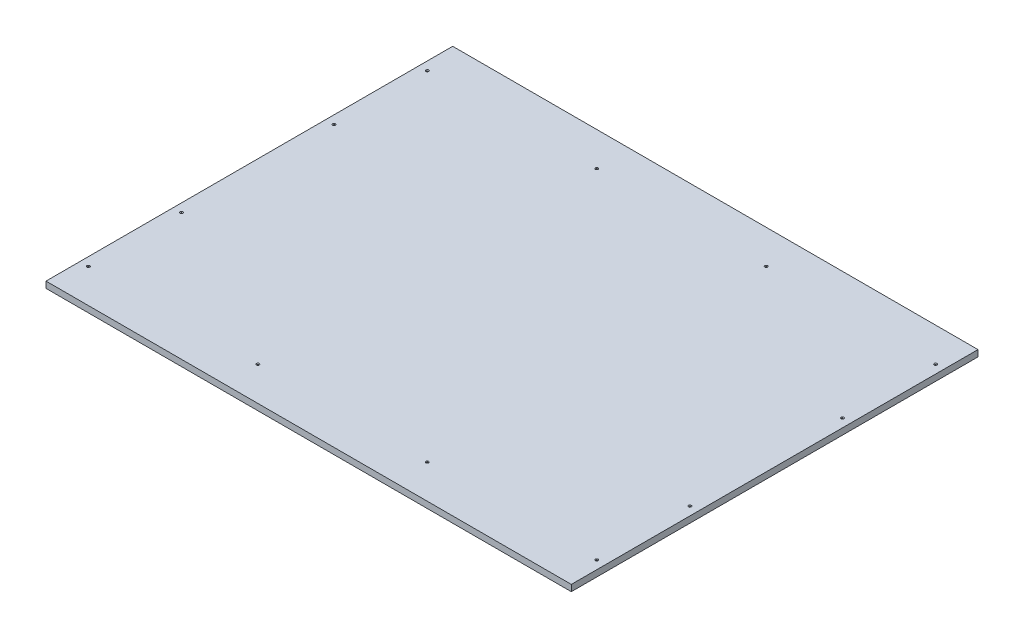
SolidWorks part; units mm, degrees
ref_plane "Front Plane" through (0, 0, 0) normal (0, 0, 1) x (1, 0, 0)
ref_plane "Top Plane" through (0, 0, 0) normal (0, 1, 0) x (1, 0, 0)
ref_plane "Right Plane" through (0, 0, 0) normal (1, 0, 0) x (0, 0, -1)
sketch "Sketch1" plane through (0, 0, 0) normal (0, 1, 0) x (1, 0, 0)
  line L1 (-1219.2, 609.6) -> (1219.2, 609.6)
  line L2 (-1219.2, 609.6) -> (-1219.2, -609.6)
  line L3 (-1219.2, -609.6) -> (1219.2, -609.6)
  line L4 (1219.2, 609.6) -> (1219.2, -609.6)
  line L5 (-1219.2, 609.6) -> (1219.2, -609.6) construction
  line L6 (-1219.2, -609.6) -> (1219.2, 609.6) construction
  point P0 (0, 0)
  dimension "D1" = 2438.4
  dimension "D2" = 1219.2
extrude "Boss-Extrude1" add sketch "Sketch1" along normal blind 19.05
sketch "Sketch2" plane through (0, 19.05, 0) normal (0, 1, 0) x (1, 0, 0)
  line L0 (-1219.2, -609.6) -> (1219.2, -609.6) construction
  line L1 (1219.2, 609.6) -> (355.6, 609.6)
  line L2 (1219.2, 609.6) -> (1219.2, -609.6)
  line L3 (1219.2, -609.6) -> (355.6, -609.6)
  line L4 (355.6, 609.6) -> (355.6, -609.6)
  dimension "D1" = 863.6
extrude "Cut-Extrude1" cut sketch "Sketch2" against normal through all
sketch "Sketch3" [suppressed] plane through (0, 18.2562, 0) normal (0, 1, 0) x (1, 0, 0)
  line L0 (304.8, 609.6) -> (304.8, -609.6) construction
  line L1 (-1219.2, -609.6) -> (304.8, -609.6)
  line L2 (-1219.2, -609.6) -> (-1219.2, -400.05)
  line L3 (-1219.2, -400.05) -> (304.8, -400.05)
  line L4 (304.8, -609.6) -> (304.8, -400.05)
  dimension "D1" = 209.55
extrude "Cut-Extrude2" [suppressed] cut sketch "Sketch3" against normal through all
hole_wizard "CSK for #8 Flat Head Machine Screw (100)1" positions "3DSketch1" profile "Sketch4" countersink size "#8" standard "ANSI Inch"
sketch3d "3DSketch1"
  line L0 (-1219.2, 19.05, -508) -> (355.6, 19.05, -508) construction
  line L1 (-1219.2, 19.05, -609.6) -> (-1219.2, 19.05, 609.6) construction
  line L2 (355.6, 19.05, -609.6) -> (355.6, 19.05, 609.6) construction
  line L4 (355.6, 19.05, -609.6) -> (-1219.2, 19.05, -609.6) construction
  point P2 (-1193.8, 19.05, -508)
  point P4 (-685.8, 19.05, -508)
  point P6 (-177.8, 19.05, -508)
  point P8 (330.2, 19.05, -508)
  dimension "D1" = 101.6
  dimension "D2" = 25.4
  dimension "D3" = 533.4
  dimension "D4" = 533.4
  dimension "D5" = 25.4
sketch "Sketch4" plane through (-1193.8, 19.05, -508) normal (1, 0, 0) x (0, 0, 1)
  line L0 (0, 0) -> (0, 19.05)
  line L1 (0, 19.05) -> (2.2479, 19.05)
  line L2 (2.2479, 19.05) -> (2.2479, 1.6518)
  line L3 (2.2479, 1.6518) -> (4.2164, 0)
  line L5 (4.2164, 0) -> (0, 0)
  line L6 (-2.2479, 1.6518) -> (-4.2164, 0) construction
  line L11 (0, -6.35) -> (0, 107.95) construction
  dimension "Thru Hole Dia." = 4.4958
  dimension "Thru Hole Depth" = 19.05
  dimension "Near C'Sink Dia." = 8.4328
  dimension "Near C'Sink Angle" = 100
hole_wizard "CSK for #8 Flat Head Machine Screw (100)2" positions "Sketch6" profile "Sketch5" countersink size "#8" standard "ANSI Inch"
sketch "Sketch6"
  line L0 (-1219.2, -508) -> (355.6, -508) construction
  line L1 (-1219.2, 609.6) -> (-1219.2, -609.6) construction
  line L2 (355.6, 609.6) -> (355.6, -609.6) construction
  line L4 (-1219.2, -609.6) -> (355.6, -609.6) construction
  line L5 (-1193.8, 609.6) -> (-1193.8, -609.6) construction
  line L6 (355.6, 609.6) -> (-1219.2, 609.6) construction
  line L8 (330.2, 609.6) -> (330.2, -609.6) construction
  line L10 (-1219.2, 508) -> (355.6, 508) construction
  line L14 (-1219.2, 228.6) -> (355.6, 228.6) construction
  line L16 (-1219.2, -228.6) -> (355.6, -228.6) construction
  line L18 (-1219.2, -479.425) -> (355.6, -479.425) construction
  point P0 (-1193.8, -508)
  point P2 (-685.8, -508)
  point P4 (-177.8, -508)
  point P6 (330.2, -508)
  point P8 (-1193.8, 508)
  point P12 (-1193.8, 228.6)
  point P14 (-1193.8, -228.6)
  point P20 (330.2, -228.6)
  point P22 (330.2, 228.6)
  point P26 (330.2, 508)
  dimension "D1" = 101.6
  dimension "D2" = 25.4
  dimension "D3" = 25.4
  dimension "D4" = 101.6
  dimension "D5" = 381
  dimension "D6" = 381
  dimension "D8" = 130.175
  dimension "D9" = 25.4
  dimension "D10" = 533.4
  dimension "D11" = 533.4
  dimension "D12" = 25.4
sketch "Sketch5" plane through (-1193.8, 19.05, 508) normal (1, 0, 0) x (0, 0, 1)
  line L0 (0, 0) -> (0, 19.05)
  line L1 (0, 19.05) -> (2.2479, 19.05)
  line L2 (2.2479, 19.05) -> (2.2479, 1.6518)
  line L3 (2.2479, 1.6518) -> (4.2164, 0)
  line L5 (4.2164, 0) -> (0, 0)
  line L6 (-2.2479, 1.6518) -> (-4.2164, 0) construction
  line L11 (0, -6.35) -> (0, 107.95) construction
  dimension "Thru Hole Dia." = 4.4958
  dimension "Thru Hole Depth" = 19.05
  dimension "Near C'Sink Dia." = 8.4328
  dimension "Near C'Sink Angle" = 100
hole_wizard "CSK for #8 Flat Head Machine Screw (100)3" positions "Sketch8" profile "Sketch7" countersink size "#8" standard "ANSI Inch"
sketch "Sketch8" plane through (0, 18.2562, 0) normal (0, 1, 0) x (1, 0, 0)
  line L0 (-1200.15, 609.6) -> (-1200.15, -400.05) construction
  line L1 (304.8, 609.6) -> (-1219.2, 609.6) construction
  line L2 (304.8, -400.05) -> (-1219.2, -400.05) construction
  line L4 (-1219.2, 590.55) -> (304.8, 590.55) construction
  line L5 (-1219.2, 609.6) -> (-1219.2, -400.05) construction
  line L6 (304.8, 609.6) -> (304.8, -400.05) construction
  line L8 (285.75, 609.6) -> (285.75, -400.05) construction
  line L10 (-1219.2, -381) -> (304.8, -381) construction
  line L12 (-1219.2, 441.325) -> (304.8, 441.325) construction
  line L14 (-1219.2, 228.6) -> (304.8, 228.6) construction
  line L16 (-1219.2, -19.05) -> (304.8, -19.05) construction
  line L18 (-1219.2, -231.775) -> (304.8, -231.775) construction
  point P0 (-1200.15, 441.325)
  point P2 (-1200.15, 228.6)
  point P4 (-1200.15, -19.05)
  point P6 (-1200.15, -231.775)
  point P8 (285.75, -231.775)
  point P10 (285.75, -19.05)
  point P12 (285.75, 228.6)
  point P14 (285.75, 441.325)
  point P16 (-1066.8, 590.55)
  point P18 (-812.8, 590.55)
  point P20 (-101.6, 590.55)
  point P22 (152.4, 590.55)
  point P24 (-1079.5, -381)
  point P26 (-584.2, -381)
  point P28 (-330.2, -381)
  point P30 (165.1, -381)
  dimension "D1" = 19.05
  dimension "D2" = 19.05
  dimension "D3" = 19.05
  dimension "D4" = 19.05
  dimension "D5" = 168.275
  dimension "D6" = 381
  dimension "D7" = 381
  dimension "D8" = 168.275
  dimension "D9" = 152.4
  dimension "D10" = 406.4
  dimension "D11" = 406.4
  dimension "D12" = 152.4
  dimension "D13" = 139.7
  dimension "D14" = 635
  dimension "D15" = 635
  dimension "D16" = 139.7
sketch "Sketch7" plane through (-1200.15, 18.2562, -441.325) normal (1, 0, 0) x (0, 0, 1)
  line L0 (0, 0) -> (0, 18.2562)
  line L1 (0, 18.2562) -> (2.2479, 18.2562)
  line L2 (2.2479, 18.2562) -> (2.2479, 1.6518)
  line L3 (2.2479, 1.6518) -> (4.2164, 0)
  line L5 (4.2164, 0) -> (0, 0)
  line L6 (-2.2479, 1.6518) -> (-4.2164, 0) construction
  line L11 (0, -6.35) -> (0, 107.95) construction
  dimension "Thru Hole Dia." = 4.4958
  dimension "Thru Hole Depth" = 18.2562
  dimension "Near C'Sink Dia." = 8.4328
  dimension "Near C'Sink Angle" = 100
